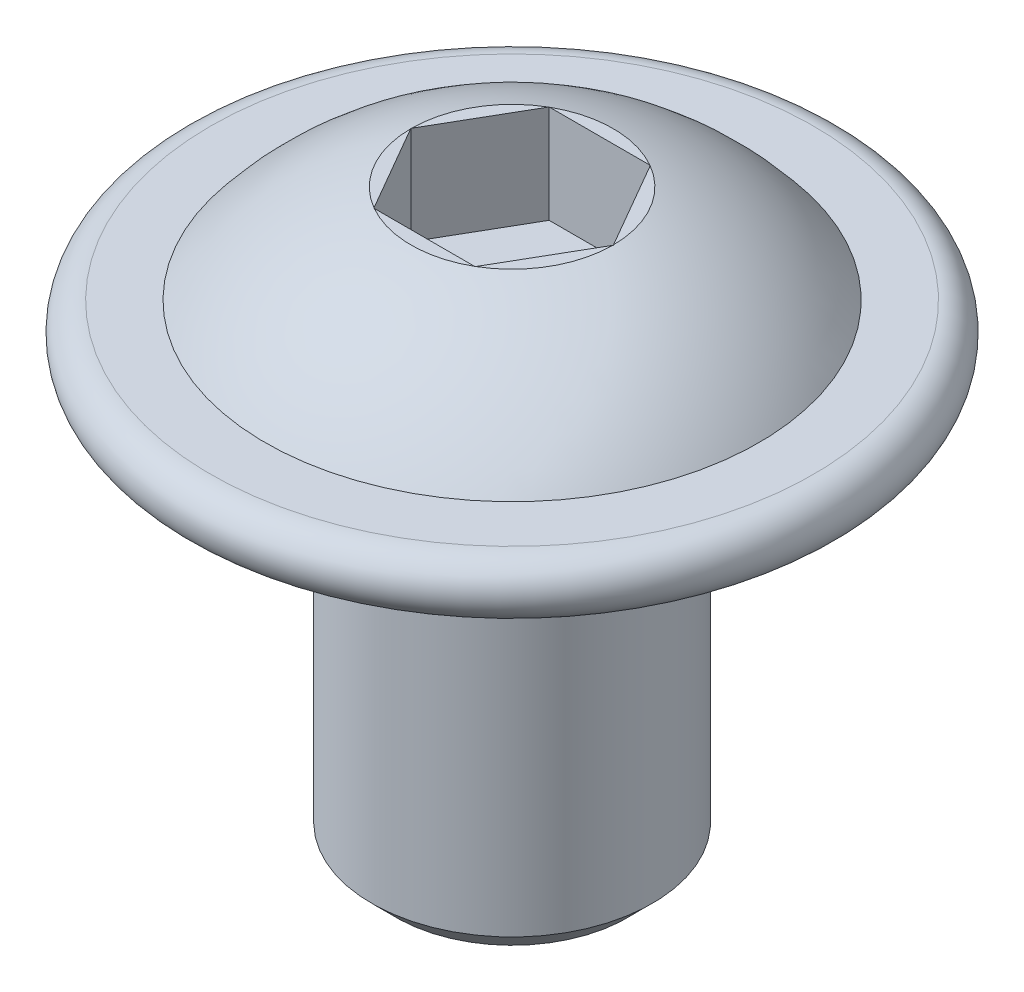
SolidWorks part; units mm, degrees
ref_plane "Plan1" through (0, 0, 0) normal (0, 0, 1) x (1, 0, 0)
ref_plane "Plan2" through (0, 0, 0) normal (0, 1, 0) x (1, 0, 0)
ref_plane "Plan3" through (0, 0, 0) normal (1, 0, 0) x (0, 0, -1)
sketch "Esquisse1" plane through (0, 0, 0) normal (0, 0, 1) x (1, 0, 0)
  line L0 (0, 2.2) -> (0, -6) construction
  line L1 (0, 2.2) -> (1.44, 2.2)
  line L2 (4.3, 0.8) -> (3.52, 0.8)
  line L3 (4.3, 0) -> (2.2, 0)
  line L4 (2, -0.2) -> (2, -5.65)
  line L5 (1.65, -6) -> (0, -6)
  line L6 (2, -5.65) -> (1.65, -6)
  line L7 (0, 2.2) -> (0, -6)
  arc A0 (1.44, 2.2) -> (3.52, 0.8) centre (0.3003, -1.7384) cw
  arc A1 (2.2, 0) -> (2, -0.2) centre (2.2, -0.2) ccw
  arc A2 (4.3, 0) -> (4.3, 0.8) centre (4.3, 0.4) ccw
  point P12 (2, -6)
  dimension "C2" = 0.2
  dimension "D3" = 4.1
  dimension "D4" = 9.4
  dimension "D1" = 2.88
  dimension "R" = 0.35
  dimension "D2" = 45
  dimension "L1" = 6
  dimension "D5" = 0.8
  dimension "D6" = 7.04
  dimension "H" = 2.2
  dimension "D" = 4
revolve "Révolution1" add sketch "Esquisse1" angle 360 about L0
sketch "Esquisse2" plane through (0, 2.2, 0) normal (0, 1, 0) x (1, 0, 0)
  line L1 (1.4434, 0) -> (0.7217, 1.25)
  line L2 (0.7217, 1.25) -> (-0.7217, 1.25)
  line L3 (-0.7217, 1.25) -> (-1.4434, 0)
  line L4 (-1.4434, 0) -> (-0.7217, -1.25)
  line L5 (-0.7217, -1.25) -> (0.7217, -1.25)
  line L6 (0.7217, -1.25) -> (1.4434, 0)
  circle A0 centre (0, 0) radius 1.25 construction
  dimension "S" = 2.5
extrude "Enlèv. mat.-Extru.1" cut sketch "Esquisse2" against normal up to surface (1.4 mm away)
equation "\"H@Esquisse1\" = \"D@Esquisse1\""
equation "\"C2@Esquisse1\"=\"D@Esquisse1\"/20"
equation "\"R@Esquisse1\"=(\"D@Esquisse1\"-\"D2@Représentation de filetage1\")/2"
